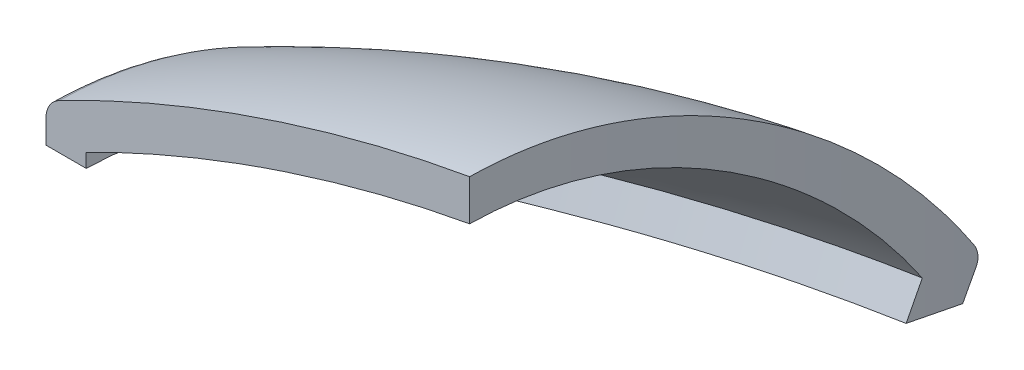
SolidWorks part; units mm, degrees
ref_plane "Front Plane" through (0, 0, 0) normal (0, 0, 1) x (1, 0, 0)
ref_plane "Top Plane" through (0, 0, 0) normal (0, 1, 0) x (1, 0, 0)
ref_plane "Right Plane" through (0, 0, 0) normal (1, 0, 0) x (0, 0, -1)
body saved out of another part "Stock-MouseMultibody-1"
